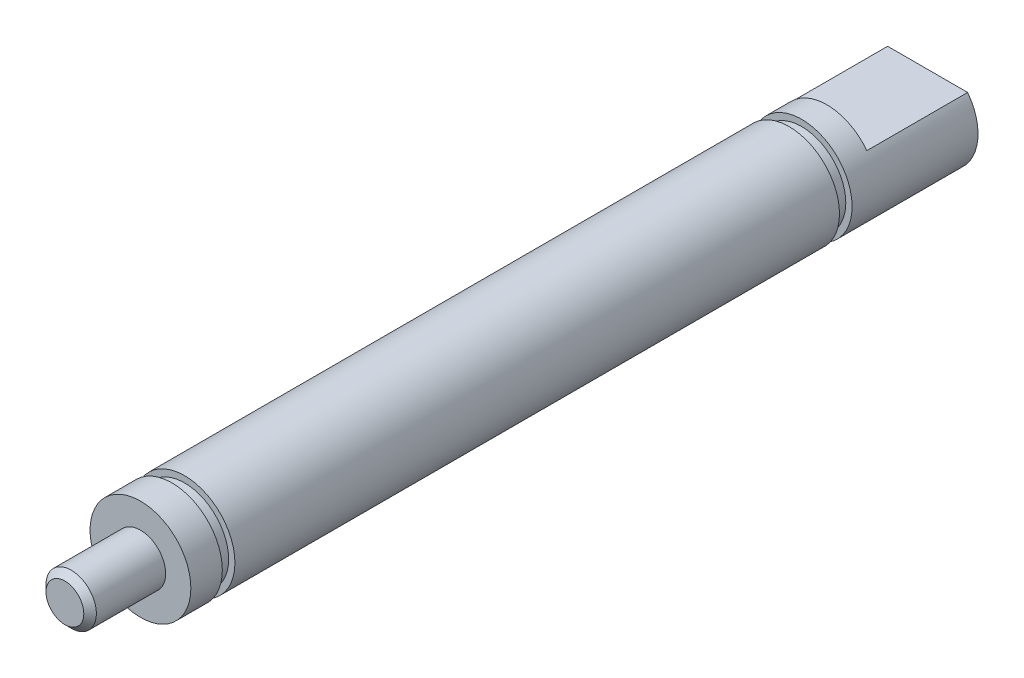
SolidWorks part; units mm, degrees
ref_plane "Plane1" through (0, 0, 0) normal (0, 0, 1) x (1, 0, 0)
ref_plane "Plane2" through (0, 0, 0) normal (0, 1, 0) x (1, 0, 0)
ref_plane "Plane3" through (0, 0, 0) normal (1, 0, 0) x (0, 0, -1)
sketch "Esquisse1" plane through (0, 0, 0) normal (0, 0, 1) x (1, 0, 0)
  line L0 (-1.5874, 1.2166) -> (1.5874, 1.2166)
  arc A0 (-1.5874, 1.2166) -> (1.5874, 1.2166) centre (0, 0) ccw
  dimension "D1" = 4
extrude "Base-Extrusion" add sketch "Esquisse1" along normal blind 4
sketch "Esquisse2" plane through (0, 0, 4) normal (0, 0, 1) x (1, 0, 0)
  circle A0 centre (0, 0) radius 2
extrude "Boss.-Extru.1" add sketch "Esquisse2" along normal blind 1
sketch "Esquisse3" plane through (0, 0, 5) normal (0, 0, 1) x (1, 0, 0)
  circle A0 centre (0, 0) radius 1.75
  dimension "D1" = 3.5
extrude "Boss.-Extru.2" add sketch "Esquisse3" along normal blind 0.5
sketch "Esquisse4" plane through (0, 0, 5.5) normal (0, 0, 1) x (1, 0, 0)
  circle A0 centre (0, 0) radius 2
  dimension "D1" = 4
extrude "Boss.-Extru.3" add sketch "Esquisse4" along normal blind 24
sketch "Esquisse5" plane through (0, 0, 29.5) normal (0, 0, 1) x (1, 0, 0)
  circle A0 centre (0, 0) radius 1.75
  dimension "D1" = 3.5
extrude "Boss.-Extru.4" add sketch "Esquisse5" along normal blind 0.5
sketch "Esquisse6" plane through (0, 0, 30) normal (0, 0, 1) x (1, 0, 0)
  circle A0 centre (0, 0) radius 2
extrude "Boss.-Extru.5" add sketch "Esquisse6" along normal blind 1.25
sketch "Esquisse7" plane through (0, 0, 31.25) normal (0, 0, 1) x (1, 0, 0)
  circle A0 centre (0, 0) radius 1
  dimension "D1" = 2
extrude "Boss.-Extru.6" add sketch "Esquisse7" along normal blind 3
chamfer "Chanfrein1" distance 0.25 angle 45
